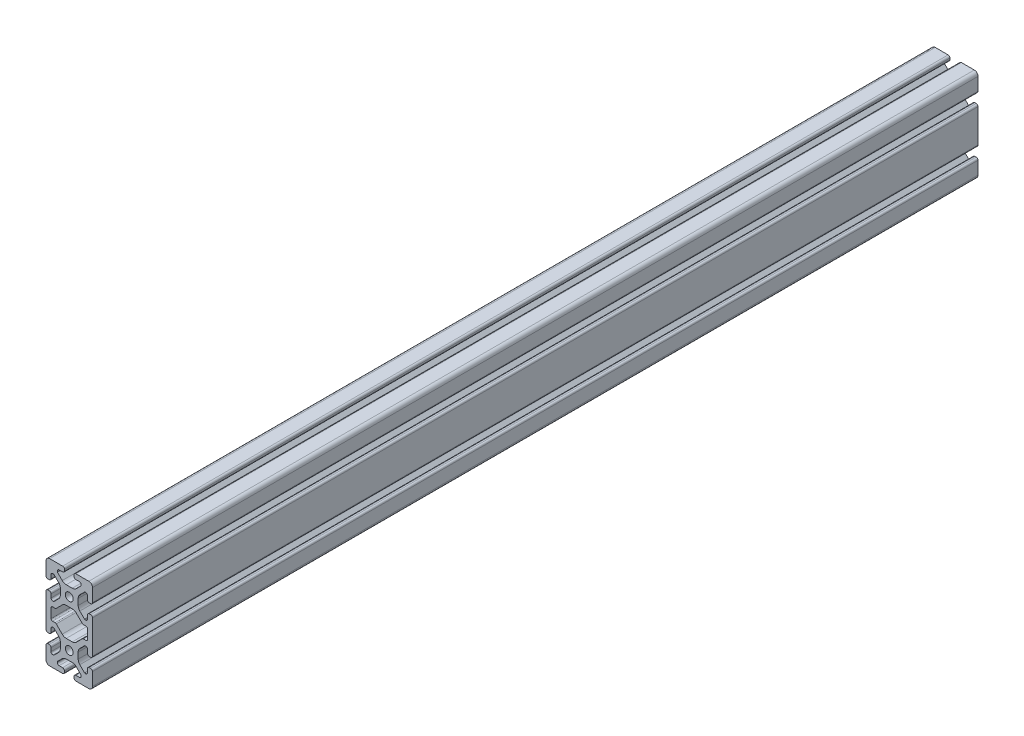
SolidWorks part; units mm, degrees
ref_plane "Front Plane" through (0, 0, 0) normal (0, 0, 1) x (1, 0, 0)
ref_plane "Top Plane" through (0, 0, 0) normal (0, 1, 0) x (1, 0, 0)
ref_plane "Right Plane" through (0, 0, 0) normal (1, 0, 0) x (0, 0, -1)
ref_plane "Plane1" through (0, 0, -3048) normal (0, 0, -1) x (-1, 0, 0)
sketch "Sketch1" plane through (0, 0, -3048) normal (0, 0, -1) x (-1, 0, 0)
  line L0 (14.41, 14.6586) -> (12.13, 14.6586)
  line L1 (11.1794, 14.2308) -> (6.0551, 9.1098)
  line L2 (2.6153, 7.685) -> (-2.6153, 7.685)
  line L3 (-6.0551, 9.1098) -> (-11.232, 14.2867)
  line L4 (-12.13, 14.6586) -> (-14.41, 14.6586)
  line L5 (-15.68, 15.9286) -> (-15.68, 24.0714)
  line L6 (-14.41, 25.3414) -> (-12.13, 25.3414)
  line L7 (-11.232, 25.7133) -> (-6.0551, 30.8902)
  line L8 (-2.6153, 32.315) -> (2.6176, 32.315)
  line L9 (6.0573, 30.8902) -> (11.1842, 25.7634)
  line L10 (12.13, 25.3414) -> (14.41, 25.3414)
  line L11 (15.68, 24.0714) -> (15.68, 15.9286)
  line L12 (16.83, 60) -> (5.6904, 60)
  line L13 (4.1204, 58.43) -> (4.1204, 57.25)
  line L14 (5.6904, 55.68) -> (8.7154, 55.68)
  line L15 (10.2854, 54.11) -> (10.2854, 53.6549)
  line L16 (10.0628, 53.1175) -> (6.0551, 49.1098)
  line L17 (2.6153, 47.685) -> (-2.6153, 47.685)
  line L18 (-6.0551, 49.1098) -> (-10.0628, 53.1175)
  line L19 (-10.2854, 53.6549) -> (-10.2854, 54.11)
  line L20 (-8.7154, 55.68) -> (-5.6904, 55.68)
  line L21 (-4.1204, 57.25) -> (-4.1204, 58.43)
  line L22 (-5.6904, 60) -> (-16.83, 60)
  line L23 (-20, 56.83) -> (-20, 45.6904)
  line L24 (-18.43, 44.1204) -> (-17.25, 44.1204)
  line L25 (-15.68, 45.6904) -> (-15.68, 48.7154)
  line L26 (-14.11, 50.2854) -> (-13.6527, 50.2854)
  line L27 (-13.1153, 50.0628) -> (-9.1098, 46.0573)
  line L28 (-7.685, 42.6176) -> (-7.685, 37.3847)
  line L29 (-9.1098, 33.9449) -> (-13.1175, 29.9372)
  line L30 (-13.6549, 29.7146) -> (-14.11, 29.7146)
  line L31 (-15.68, 31.2846) -> (-15.68, 34.3096)
  line L32 (-17.25, 35.8796) -> (-18.43, 35.8796)
  line L33 (-20, 34.3096) -> (-20, 5.6904)
  line L34 (-18.43, 4.1204) -> (-17.25, 4.1204)
  line L35 (-15.68, 5.6904) -> (-15.68, 8.7154)
  line L36 (-14.11, 10.2854) -> (-13.6549, 10.2854)
  line L37 (-13.1175, 10.0628) -> (-9.1098, 6.0551)
  line L38 (-7.685, 2.6153) -> (-7.685, -2.6153)
  line L39 (-9.1098, -6.0551) -> (-13.1175, -10.0628)
  line L40 (-13.6549, -10.2854) -> (-14.11, -10.2854)
  line L41 (-15.68, -8.7154) -> (-15.68, -5.6904)
  line L42 (-17.25, -4.1204) -> (-18.43, -4.1204)
  line L43 (-20, -5.6904) -> (-20, -16.83)
  line L44 (-16.83, -20) -> (-5.6904, -20)
  line L45 (-4.1204, -18.43) -> (-4.1204, -17.25)
  line L46 (-5.6904, -15.68) -> (-8.7154, -15.68)
  line L47 (-10.2854, -14.11) -> (-10.2854, -13.6549)
  line L48 (-10.0628, -13.1175) -> (-6.0551, -9.1098)
  line L49 (-2.6153, -7.685) -> (2.6153, -7.685)
  line L50 (6.0551, -9.1098) -> (10.0628, -13.1175)
  line L51 (10.2854, -13.6549) -> (10.2854, -14.11)
  line L52 (8.7154, -15.68) -> (5.6904, -15.68)
  line L53 (4.1204, -17.25) -> (4.1204, -18.43)
  line L54 (5.6904, -20) -> (16.83, -20)
  line L55 (20, -16.83) -> (20, -5.6904)
  line L56 (18.43, -4.1204) -> (17.25, -4.1204)
  line L57 (15.68, -5.6904) -> (15.68, -8.7154)
  line L58 (14.11, -10.2854) -> (13.6549, -10.2854)
  line L59 (13.1175, -10.0628) -> (9.1098, -6.0551)
  line L60 (7.685, -2.6153) -> (7.685, 2.6153)
  line L61 (9.1098, 6.0551) -> (13.1175, 10.0628)
  line L62 (13.6549, 10.2854) -> (14.11, 10.2854)
  line L63 (15.68, 8.7154) -> (15.68, 5.6904)
  line L64 (17.25, 4.1204) -> (18.43, 4.1204)
  line L65 (20, 5.6904) -> (20, 34.3096)
  line L66 (18.43, 35.8796) -> (17.25, 35.8796)
  line L67 (15.68, 34.3096) -> (15.68, 31.2846)
  line L68 (14.11, 29.7146) -> (13.6549, 29.7146)
  line L69 (13.1175, 29.9372) -> (9.1098, 33.9449)
  line L70 (7.685, 37.3847) -> (7.685, 42.6153)
  line L71 (9.1098, 46.0551) -> (13.1175, 50.0628)
  line L72 (13.6549, 50.2854) -> (14.11, 50.2854)
  line L73 (15.68, 48.7154) -> (15.68, 45.6904)
  line L74 (17.25, 44.1204) -> (18.43, 44.1204)
  line L75 (20, 45.6904) -> (20, 56.83)
  arc A0 (15.68, 15.9286) -> (14.41, 14.6586) centre (14.41, 15.9286) cw
  arc A1 (12.13, 14.6586) -> (11.1794, 14.2308) centre (12.13, 13.3886) ccw
  arc A2 (6.0551, 9.1098) -> (2.6153, 7.685) centre (2.6153, 12.5496) cw
  arc A3 (-2.6153, 7.685) -> (-6.0551, 9.1098) centre (-2.6153, 12.5496) cw
  arc A4 (-11.232, 14.2867) -> (-12.13, 14.6586) centre (-12.13, 13.3886) ccw
  arc A5 (-14.41, 14.6586) -> (-15.68, 15.9286) centre (-14.41, 15.9286) cw
  arc A6 (-15.68, 24.0714) -> (-14.41, 25.3414) centre (-14.41, 24.0714) cw
  arc A7 (-12.13, 25.3414) -> (-11.232, 25.7133) centre (-12.13, 26.6114) ccw
  arc A8 (-6.0551, 30.8902) -> (-2.6153, 32.315) centre (-2.6153, 27.4504) cw
  arc A9 (2.6176, 32.315) -> (6.0573, 30.8902) centre (2.6176, 27.4504) cw
  arc A10 (11.1842, 25.7634) -> (12.13, 25.3414) centre (12.13, 26.6123) ccw
  arc A11 (14.41, 25.3414) -> (15.68, 24.0714) centre (14.41, 24.0714) cw
  circle A12 centre (0, 0) radius 3.405
  circle A13 centre (0, 40) radius 3.405
  arc A14 (5.6904, 60) -> (4.1204, 58.43) centre (5.6904, 58.43) ccw
  arc A15 (4.1204, 57.25) -> (5.6904, 55.68) centre (5.6904, 57.25) ccw
  arc A16 (8.7154, 55.68) -> (10.2854, 54.11) centre (8.7154, 54.11) cw
  arc A17 (10.2854, 53.6549) -> (10.0628, 53.1175) centre (9.5254, 53.6549) cw
  arc A18 (6.0551, 49.1098) -> (2.6153, 47.685) centre (2.6153, 52.5496) cw
  arc A19 (-2.6153, 47.685) -> (-6.0551, 49.1098) centre (-2.6153, 52.5496) cw
  arc A20 (-10.0628, 53.1175) -> (-10.2854, 53.6549) centre (-9.5254, 53.6549) cw
  arc A21 (-10.2854, 54.11) -> (-8.7154, 55.68) centre (-8.7154, 54.11) cw
  arc A22 (-5.6904, 55.68) -> (-4.1204, 57.25) centre (-5.6904, 57.25) ccw
  arc A23 (-4.1204, 58.43) -> (-5.6904, 60) centre (-5.6904, 58.43) ccw
  arc A24 (-16.83, 60) -> (-20, 56.83) centre (-16.83, 56.83) ccw
  arc A25 (-20, 45.6904) -> (-18.43, 44.1204) centre (-18.43, 45.6904) ccw
  arc A26 (-17.25, 44.1204) -> (-15.68, 45.6904) centre (-17.25, 45.6904) ccw
  arc A27 (-15.68, 48.7154) -> (-14.11, 50.2854) centre (-14.11, 48.7154) cw
  arc A28 (-13.6527, 50.2854) -> (-13.1153, 50.0628) centre (-13.6527, 49.5254) cw
  arc A29 (-9.1098, 46.0573) -> (-7.685, 42.6176) centre (-12.5496, 42.6176) cw
  arc A30 (-7.685, 37.3847) -> (-9.1098, 33.9449) centre (-12.5496, 37.3847) cw
  arc A31 (-13.1175, 29.9372) -> (-13.6549, 29.7146) centre (-13.6549, 30.4746) cw
  arc A32 (-14.11, 29.7146) -> (-15.68, 31.2846) centre (-14.11, 31.2846) cw
  arc A33 (-15.68, 34.3096) -> (-17.25, 35.8796) centre (-17.25, 34.3096) ccw
  arc A34 (-18.43, 35.8796) -> (-20, 34.3096) centre (-18.43, 34.3096) ccw
  arc A35 (-20, 5.6904) -> (-18.43, 4.1204) centre (-18.43, 5.6904) ccw
  arc A36 (-17.25, 4.1204) -> (-15.68, 5.6904) centre (-17.25, 5.6904) ccw
  arc A37 (-15.68, 8.7154) -> (-14.11, 10.2854) centre (-14.11, 8.7154) cw
  arc A38 (-13.6549, 10.2854) -> (-13.1175, 10.0628) centre (-13.6549, 9.5254) cw
  arc A39 (-9.1098, 6.0551) -> (-7.685, 2.6153) centre (-12.5496, 2.6153) cw
  arc A40 (-7.685, -2.6153) -> (-9.1098, -6.0551) centre (-12.5496, -2.6153) cw
  arc A41 (-13.1175, -10.0628) -> (-13.6549, -10.2854) centre (-13.6549, -9.5254) cw
  arc A42 (-14.11, -10.2854) -> (-15.68, -8.7154) centre (-14.11, -8.7154) cw
  arc A43 (-15.68, -5.6904) -> (-17.25, -4.1204) centre (-17.25, -5.6904) ccw
  arc A44 (-18.43, -4.1204) -> (-20, -5.6904) centre (-18.43, -5.6904) ccw
  arc A45 (-20, -16.83) -> (-16.83, -20) centre (-16.83, -16.83) ccw
  arc A46 (-5.6904, -20) -> (-4.1204, -18.43) centre (-5.6904, -18.43) ccw
  arc A47 (-4.1204, -17.25) -> (-5.6904, -15.68) centre (-5.6904, -17.25) ccw
  arc A48 (-8.7154, -15.68) -> (-10.2854, -14.11) centre (-8.7154, -14.11) cw
  arc A49 (-10.2854, -13.6549) -> (-10.0628, -13.1175) centre (-9.5254, -13.6549) cw
  arc A50 (-6.0551, -9.1098) -> (-2.6153, -7.685) centre (-2.6153, -12.5496) cw
  arc A51 (2.6153, -7.685) -> (6.0551, -9.1098) centre (2.6153, -12.5496) cw
  arc A52 (10.0628, -13.1175) -> (10.2854, -13.6549) centre (9.5254, -13.6549) cw
  arc A53 (10.2854, -14.11) -> (8.7154, -15.68) centre (8.7154, -14.11) cw
  arc A54 (5.6904, -15.68) -> (4.1204, -17.25) centre (5.6904, -17.25) ccw
  arc A55 (4.1204, -18.43) -> (5.6904, -20) centre (5.6904, -18.43) ccw
  arc A56 (16.83, -20) -> (20, -16.83) centre (16.83, -16.83) ccw
  arc A57 (20, -5.6904) -> (18.43, -4.1204) centre (18.43, -5.6904) ccw
  arc A58 (17.25, -4.1204) -> (15.68, -5.6904) centre (17.25, -5.6904) ccw
  arc A59 (15.68, -8.7154) -> (14.11, -10.2854) centre (14.11, -8.7154) cw
  arc A60 (13.6549, -10.2854) -> (13.1175, -10.0628) centre (13.6549, -9.5254) cw
  arc A61 (9.1098, -6.0551) -> (7.685, -2.6153) centre (12.5496, -2.6153) cw
  arc A62 (7.685, 2.6153) -> (9.1098, 6.0551) centre (12.5496, 2.6153) cw
  arc A63 (13.1175, 10.0628) -> (13.6549, 10.2854) centre (13.6549, 9.5254) cw
  arc A64 (14.11, 10.2854) -> (15.68, 8.7154) centre (14.11, 8.7154) cw
  arc A65 (15.68, 5.6904) -> (17.25, 4.1204) centre (17.25, 5.6904) ccw
  arc A66 (18.43, 4.1204) -> (20, 5.6904) centre (18.43, 5.6904) ccw
  arc A67 (20, 34.3096) -> (18.43, 35.8796) centre (18.43, 34.3096) ccw
  arc A68 (17.25, 35.8796) -> (15.68, 34.3096) centre (17.25, 34.3096) ccw
  arc A69 (15.68, 31.2846) -> (14.11, 29.7146) centre (14.11, 31.2846) cw
  arc A70 (13.6549, 29.7146) -> (13.1175, 29.9372) centre (13.6549, 30.4746) cw
  arc A71 (9.1098, 33.9449) -> (7.685, 37.3847) centre (12.5496, 37.3847) cw
  arc A72 (7.685, 42.6153) -> (9.1098, 46.0551) centre (12.5496, 42.6153) cw
  arc A73 (13.1175, 50.0628) -> (13.6549, 50.2854) centre (13.6549, 49.5254) cw
  arc A74 (14.11, 50.2854) -> (15.68, 48.7154) centre (14.11, 48.7154) cw
  arc A75 (15.68, 45.6904) -> (17.25, 44.1204) centre (17.25, 45.6904) ccw
  arc A76 (18.43, 44.1204) -> (20, 45.6904) centre (18.43, 45.6904) ccw
  arc A77 (20, 56.83) -> (16.83, 60) centre (16.83, 56.83) ccw
extrude "Boss-Extrude1" add sketch "Sketch1" against normal blind 3048
ref_plane "2.5 ft cut1" through (0, 0, -762) normal (0, 0, 1) x (1, 0, 0)
ref_plane "2.5 ft cut2" through (0, 0, -1524) normal (0, 0, 1) x (1, 0, 0)
ref_plane "16.14 in cut3" through (0, 0, -1933.956) normal (0, 0, 1) x (1, 0, 0)
ref_plane "13 in cut4" through (0, 0, -2264.156) normal (0, 0, 1) x (1, 0, 0)
ref_plane "midplane cut5" through (0, 0, -2656.078) normal (0, 0, 1) x (1, 0, 0)
sketch "Sketch26" plane through (0, 0, -762) normal (0, 0, 1) x (1, 0, 0)
  line L0 (-20, -20.8001) -> (20, -20.8001)
  line L1 (-20, -20.8001) -> (-20, 60)
  line L2 (-20, 60) -> (20, 60)
  line L3 (20, -20.8001) -> (20, 60)
sketch "Sketch33" plane through (0, 0, -1524) normal (0, 0, 1) x (1, 0, 0)
  line L5 (-20, 60) -> (20, 60)
  line L6 (-20, 60) -> (-20, -20.8001)
  line L7 (-20, -20.8001) -> (20, -20.8001)
  line L8 (20, 60) -> (20, -20.8001)
sketch "Sketch41" plane through (0, 0, -1933.956) normal (0, 0, 1) x (1, 0, 0)
  line L0 (-20, -20.8001) -> (20, -20.8001)
  line L1 (-20, -20.8001) -> (-20, 60)
  line L2 (-20, 60) -> (20, 60)
  line L3 (20, -20.8001) -> (20, 60)
sketch "Sketch50" plane through (0, 0, -2264.156) normal (0, 0, 1) x (1, 0, 0)
  line L0 (-20, -20.8001) -> (20, -20.8001)
  line L1 (-20, -20.8001) -> (-20, 60)
  line L2 (-20, 60) -> (20, 60)
  line L3 (20, -20.8001) -> (20, 60)
sketch "Sketch51" plane through (0, 0, -2656.078) normal (0, 0, 1) x (1, 0, 0)
  line L1 (-20, 60) -> (20, 60)
  line L2 (-20, 60) -> (-20, -20.8001)
  line L3 (-20, -20.8001) -> (20, -20.8001)
  line L4 (20, 60) -> (20, -20.8001)
extrude "Cut-Extrude1" cut sketch "Sketch26" along normal through all
extrude "Cut-Extrude2" cut sketch "Sketch33" against normal through all
